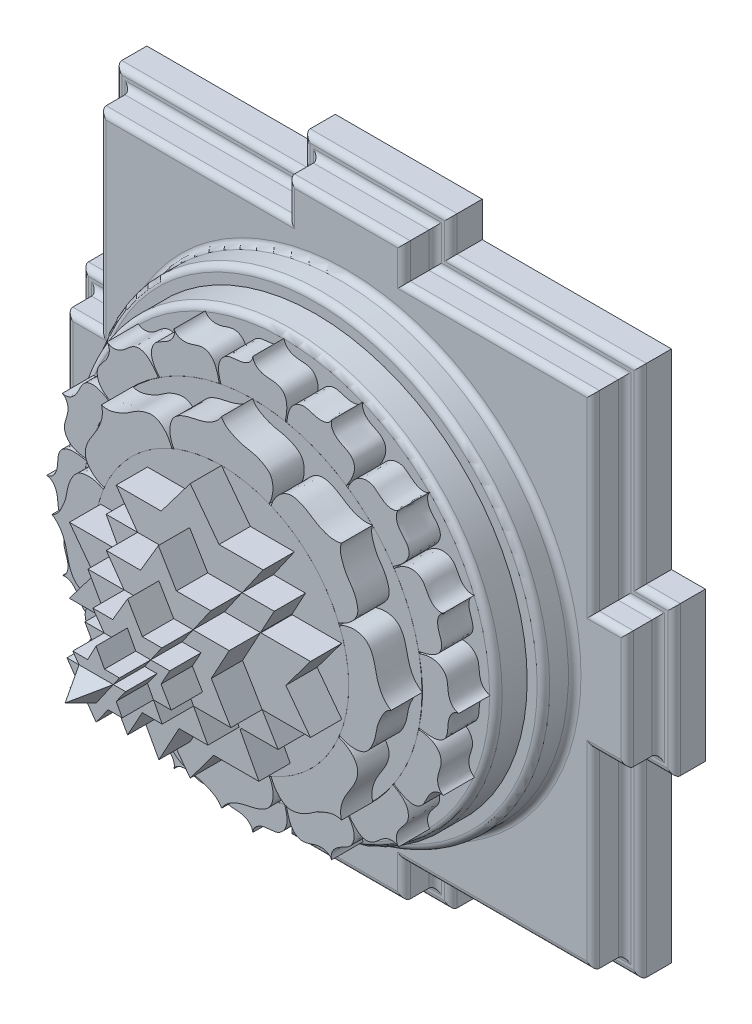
SolidWorks part; units mm, degrees
ref_plane "Front Plane" through (0, 0, 0) normal (0, 0, 1) x (1, 0, 0)
ref_plane "Top Plane" through (0, 0, 0) normal (0, 1, 0) x (1, 0, 0)
ref_plane "Right Plane" through (0, 0, 0) normal (1, 0, 0) x (0, 0, -1)
sketch "Sketch1" plane through (0, 0, 0) normal (0, 0, 1) x (1, 0, 0)
  line L0 (91.8709, 61.5854) -> (97.2817, 61.5854)
  line L1 (8.0648, 7.1622) -> (38.1677, 7.1622)
  line L2 (8.0648, 7.1622) -> (8.0648, 37.7603)
  line L3 (8.0648, 92.1075) -> (38.1677, 92.1075)
  line L4 (91.8709, 7.1622) -> (91.8709, 37.7603)
  line L5 (97.2817, 61.5854) -> (97.2817, 37.7603)
  line L6 (97.2817, 37.7603) -> (91.8709, 37.7603)
  line L7 (91.8709, 61.5854) -> (91.8709, 92.1075)
  line L8 (38.1677, 92.1075) -> (38.1677, 97.7125)
  line L9 (38.1677, 97.7125) -> (61.6437, 97.7125)
  line L10 (61.6437, 97.7125) -> (61.6437, 92.1075)
  line L11 (61.6437, 92.1075) -> (91.8709, 92.1075)
  line L12 (8.0648, 61.5854) -> (2.7372, 61.5854)
  line L13 (2.7372, 61.5854) -> (2.7372, 37.7603)
  line L14 (2.7372, 37.7603) -> (8.0648, 37.7603)
  line L15 (8.0648, 61.5854) -> (8.0648, 92.1075)
  line L16 (38.1677, 7.1622) -> (38.1677, 1.6556)
  line L17 (38.1677, 1.6556) -> (61.6437, 1.6556)
  line L18 (61.6437, 1.6556) -> (61.6437, 7.1622)
  line L19 (61.6437, 7.1622) -> (91.8709, 7.1622)
  line L20 (49.9915, 49.7105) -> (49.9915, 103.8967) construction
  line L21 (49.9915, 49.7105) -> (49.9915, -8.4046) construction
  line L22 (0, 49.6729) -> (100.4125, 49.6729) construction
  line L23 (89.3709, 59.0854) -> (94.7817, 59.0854) construction
  line L24 (94.7817, 59.0854) -> (94.7817, 40.2603) construction
  line L25 (94.7817, 40.2603) -> (89.3709, 40.2603) construction
  line L26 (89.3709, 9.6622) -> (89.3709, 40.2603) construction
  line L27 (59.1437, 9.6622) -> (89.3709, 9.6622) construction
  line L28 (59.1437, 4.1556) -> (59.1437, 9.6622) construction
  line L29 (40.6677, 4.1556) -> (59.1437, 4.1556) construction
  line L30 (40.6677, 9.6622) -> (40.6677, 4.1556) construction
  line L31 (10.5648, 9.6622) -> (40.6677, 9.6622) construction
  line L32 (10.5648, 9.6622) -> (10.5648, 40.2603) construction
  line L33 (5.2372, 40.2603) -> (10.5648, 40.2603) construction
  line L34 (5.2372, 59.0854) -> (5.2372, 40.2603) construction
  line L35 (10.5648, 59.0854) -> (5.2372, 59.0854) construction
  line L36 (10.5648, 59.0854) -> (10.5648, 89.6075) construction
  line L37 (10.5648, 89.6075) -> (40.6677, 89.6075) construction
  line L38 (40.6677, 89.6075) -> (40.6677, 95.2125) construction
  line L39 (40.6677, 95.2125) -> (59.1437, 95.2125) construction
  line L40 (59.1437, 95.2125) -> (59.1437, 89.6075) construction
  line L41 (59.1437, 89.6075) -> (89.3709, 89.6075) construction
  line L42 (89.3709, 59.0854) -> (89.3709, 89.6075) construction
  line L43 (49.9915, 70.039) -> (30.7006, 44.5216) construction
  line L44 (30.7006, 55.0402) -> (69.204, 55.0402) construction
  line L46 (30.7006, 44.5216) -> (69.204, 44.5216) construction
  line L48 (49.9915, 70.039) -> (69.204, 44.5216) construction
  line L49 (49.9915, 29.2962) -> (30.7006, 55.0402) construction
  line L50 (49.9915, 29.2962) -> (69.204, 55.0402) construction
  line L51 (36.5629, 59.0854) -> (63.4118, 59.0854) construction
  line L52 (63.4118, 59.0854) -> (49.9915, 34.3322) construction
  line L53 (49.9915, 34.3322) -> (36.5629, 59.0854) construction
  line L54 (49.9915, 47.1902) -> (38.1677, 63.9162) construction
  line L55 (38.1677, 63.9162) -> (61.6437, 63.9162) construction
  line L56 (61.6437, 63.9162) -> (49.9915, 47.1902) construction
  line L57 (39.0188, 34.3322) -> (49.9523, 55.0402) construction
  line L58 (49.9523, 55.0402) -> (60.9717, 34.3322) construction
  line L59 (60.9717, 34.3322) -> (39.0188, 34.3322) construction
  line L60 (35.9529, 40.2603) -> (64.0301, 40.2603) construction
  line L61 (64.0301, 40.2603) -> (49.9057, 63.9162) construction
  line L62 (49.9057, 63.9162) -> (35.9529, 40.2603) construction
  line L63 (43.016, 47.1902) -> (56.9627, 47.1902) construction
  line L64 (56.9627, 47.1902) -> (49.9874, 59.0854) construction
  line L65 (49.9874, 59.0854) -> (43.016, 47.1902) construction
  line L66 (43.1709, 52.4977) -> (49.9915, 40.2603) construction
  line L67 (49.9915, 40.2603) -> (56.7234, 52.4977) construction
  line L68 (56.7234, 52.4977) -> (43.1709, 52.4977) construction
  line L69 (45.3025, 51.0916) -> (54.675, 51.0916) construction
  line L70 (54.675, 51.0916) -> (49.9523, 44.5216) construction
  line L71 (49.9523, 44.5216) -> (45.3025, 51.0916) construction
  circle A0 centre (49.9915, 49.7105) radius 36.4206 construction
  circle A1 centre (49.9915, 49.7105) radius 33.8286 construction
  circle A2 centre (49.9915, 49.7105) radius 20.3285 construction
  circle A3 centre (49.9915, 49.7105) radius 27.0358 construction
  circle A4 centre (49.9915, 49.7105) radius 27.0358 construction
  circle A5 centre (49.9915, 49.7105) radius 27.0358 construction
  circle A6 centre (49.9915, 49.7105) radius 27.0358 construction
  circle A7 centre (49.9915, 49.7105) radius 27.0358 construction
  circle A8 centre (49.9915, 49.7105) radius 27.0358 construction
  circle A9 centre (49.9915, 49.7105) radius 27.0358 construction
  circle A10 centre (49.9915, 49.7105) radius 27.0358 construction
  spline S0 degree 3 poles (42.3744, 68.558) (41.678, 69.6765) (41.3285, 72.6041) (44.2873, 74.1529) (47.1806, 74.5198) (49.2793, 75.5729) (49.9915, 76.8036) knots 0 0 0 0 0.328948 0.496786 0.694085 1 1 1 1 construction
  spline S1 degree 3 poles (57.6087, 68.558) (58.0096, 69.3799) (58.3859, 70.755) (57.9282, 72.8222) (56.5346, 73.7475) (55.0018, 74.3404) (53.4246, 74.4795) (51.6109, 75.2438) (50.3695, 75.9152) (49.9915, 76.8036) knots 0 0 0 0 0.204713 0.31623 0.449473 0.557768 0.688287 0.80075 1 1 1 1 construction
  spline S2 degree 3 poles (57.9326, 68.4238) (58.2311, 69.7071) (60.0541, 72.0244) (63.2414, 71.0273) (65.5467, 69.241) (67.7754, 68.5015) (69.1492, 68.8682) knots 0 0 0 0 0.328948 0.496786 0.694085 1 1 1 1 construction
  spline S3 degree 3 poles (68.7049, 57.6515) (69.5696, 57.9492) (70.808, 58.6555) (71.9461, 60.4409) (71.6149, 62.0806) (70.9503, 63.5836) (69.9334, 64.7972) (69.1914, 66.6201) (68.7883, 67.9728) (69.1492, 68.8682) knots 0 0 0 0 0.204713 0.31623 0.449473 0.557768 0.688287 0.80075 1 1 1 1 construction
  spline S4 degree 3 poles (68.839, 57.3276) (69.9576, 58.024) (72.8851, 58.3735) (74.4339, 55.4147) (74.8009, 52.5214) (75.8539, 50.4227) (77.0846, 49.7105) knots 0 0 0 0 0.328948 0.496786 0.694085 1 1 1 1 construction
  spline S5 degree 3 poles (68.839, 42.0933) (69.661, 41.6924) (71.0361, 41.3161) (73.1033, 41.7738) (74.0285, 43.1674) (74.6214, 44.7002) (74.7605, 46.2774) (75.5248, 48.091) (76.1963, 49.3325) (77.0846, 49.7105) knots 0 0 0 0 0.204713 0.31623 0.449473 0.557768 0.688287 0.80075 1 1 1 1 construction
  spline S6 degree 3 poles (68.7049, 41.7694) (69.9882, 41.4709) (72.3054, 39.6479) (71.3084, 36.4606) (69.5221, 34.1552) (68.7826, 31.9266) (69.1492, 30.5528) knots 0 0 0 0 0.328948 0.496786 0.694085 1 1 1 1 construction
  spline S7 degree 3 poles (57.9326, 30.9971) (58.2303, 30.1324) (58.9366, 28.894) (60.7219, 27.7559) (62.3616, 28.0871) (63.8647, 28.7517) (65.0783, 29.7686) (66.9012, 30.5106) (68.2538, 30.9137) (69.1492, 30.5528) knots 0 0 0 0 0.204713 0.31623 0.449473 0.557768 0.688287 0.80075 1 1 1 1 construction
  spline S8 degree 3 poles (57.6087, 30.863) (58.305, 29.7444) (58.6546, 26.8169) (55.6958, 25.2681) (52.8025, 24.9011) (50.7037, 23.8481) (49.9915, 22.6174) knots 0 0 0 0 0.328948 0.496786 0.694085 1 1 1 1 construction
  spline S9 degree 3 poles (42.3744, 30.863) (41.9735, 30.041) (41.5972, 28.6659) (42.0549, 26.5987) (43.4485, 25.6734) (44.9812, 25.0806) (46.5584, 24.9415) (48.3721, 24.1772) (49.6136, 23.5057) (49.9915, 22.6174) knots 0 0 0 0 0.204713 0.31623 0.449473 0.557768 0.688287 0.80075 1 1 1 1 construction
  spline S10 degree 3 poles (42.0505, 30.9971) (41.7519, 29.7138) (39.929, 27.3966) (36.7416, 28.3936) (34.4363, 30.1799) (32.2077, 30.9194) (30.8338, 30.5528) knots 0 0 0 0 0.328948 0.496786 0.694085 1 1 1 1 construction
  spline S11 degree 3 poles (31.2782, 41.7694) (30.4135, 41.4717) (29.1751, 40.7654) (28.037, 38.9801) (28.3681, 37.3404) (29.0328, 35.8373) (30.0496, 34.6237) (30.7917, 32.8008) (31.1947, 31.4481) (30.8338, 30.5528) knots 0 0 0 0 0.204713 0.31623 0.449473 0.557768 0.688287 0.80075 1 1 1 1 construction
  spline S12 degree 3 poles (31.144, 42.0933) (30.0255, 41.397) (27.0979, 41.0474) (25.5491, 44.0062) (25.1821, 46.8995) (24.1291, 48.9983) (22.8984, 49.7105) knots 0 0 0 0 0.328948 0.496786 0.694085 1 1 1 1 construction
  spline S13 degree 3 poles (31.144, 57.3276) (30.3221, 57.7285) (28.9469, 58.1048) (26.8798, 57.6471) (25.9545, 56.2535) (25.3616, 54.7207) (25.2225, 53.1436) (24.4582, 51.3299) (23.7868, 50.0884) (22.8984, 49.7105) knots 0 0 0 0 0.204713 0.31623 0.449473 0.557768 0.688287 0.80075 1 1 1 1 construction
  spline S14 degree 3 poles (31.2782, 57.6515) (29.9949, 57.9501) (27.6776, 59.773) (28.6746, 62.9603) (30.461, 65.2657) (31.2005, 67.4943) (30.8338, 68.8682) knots 0 0 0 0 0.328948 0.496786 0.694085 1 1 1 1 construction
  spline S15 degree 3 poles (42.0505, 68.4238) (41.7527, 69.2885) (41.0464, 70.5269) (39.2611, 71.665) (37.6214, 71.3339) (36.1184, 70.6692) (34.9048, 69.6524) (33.0819, 68.9103) (31.7292, 68.5073) (30.8338, 68.8682) knots 0 0 0 0 0.204713 0.31623 0.449473 0.557768 0.688287 0.80075 1 1 1 1 construction
  spline S16 degree 3 poles (44.9079, 76.264) (44.55, 77.2257) (44.1955, 79.0675) (45.7969, 80.7695) (47.2713, 80.8646) (48.8817, 81.0181) (49.933, 81.8258) (49.9915, 82.6408) knots 0 0 0 0 0.329339 0.49933 0.645631 0.769103 1 1 1 1 construction
  spline S17 degree 3 poles (55.1908, 76.2416) (55.3246, 76.8595) (55.4839, 77.9702) (55.3665, 79.4391) (54.6851, 80.4437) (53.6927, 80.8384) (52.5831, 80.8617) (51.0898, 81.0373) (50.087, 81.7878) (49.9915, 82.6408) knots 0 0 0 0 0.191549 0.34424 0.434225 0.546003 0.652539 0.772913 1 1 1 1 construction
  spline S18 degree 3 poles (64.9481, 72.2324) (65.3081, 72.752) (65.8803, 73.7172) (66.334, 75.1192) (66.0889, 76.3082) (65.3231, 77.0525) (64.3069, 77.4987) (62.9945, 78.2324) (62.3552, 79.3095) (62.5934, 80.1342) knots 0 0 0 0 0.191549 0.34424 0.434225 0.546003 0.652539 0.772913 1 1 1 1 construction
  spline S19 degree 3 poles (55.4564, 76.1882) (55.4938, 77.2136) (55.8712, 79.0509) (58.002, 80.0104) (59.4005, 79.5341) (60.9471, 79.0596) (62.2275, 79.4036) (62.5934, 80.1342) knots 0 0 0 0 0.329339 0.49933 0.645631 0.769103 1 1 1 1 construction
  spline S20 degree 3 poles (72.4283, 64.7944) (72.9599, 65.1367) (73.8579, 65.8095) (74.8135, 66.9311) (75.0421, 68.1233) (74.6194, 69.1041) (73.8513, 69.9052) (72.9196, 71.0853) (72.7411, 72.325) (73.2768, 72.9957) knots 0 0 0 0 0.191549 0.34424 0.434225 0.546003 0.652539 0.772913 1 1 1 1 construction
  spline S21 degree 3 poles (65.173, 72.0814) (65.6, 73.0145) (66.6517, 74.5675) (68.9875, 74.6385) (70.0973, 73.6632) (71.3446, 72.633) (72.6591, 72.4609) (73.2768, 72.9957) knots 0 0 0 0 0.329339 0.49933 0.645631 0.769103 1 1 1 1 construction
  spline S22 degree 3 poles (76.4928, 55.06) (77.1149, 55.1728) (78.202, 55.4507) (79.5141, 56.1213) (80.1815, 57.1353) (80.1664, 58.2031) (79.7633, 59.2373) (79.3541, 60.6841) (79.6637, 61.8977) (80.4152, 62.3124) knots 0 0 0 0 0.191549 0.34424 0.434225 0.546003 0.652539 0.772913 1 1 1 1 construction
  spline S23 degree 3 poles (72.5784, 64.5688) (73.3299, 65.2674) (74.8959, 66.2998) (77.0811, 65.4715) (77.7332, 64.1458) (78.4913, 62.7167) (79.6399, 62.0546) (80.4152, 62.3124) knots 0 0 0 0 0.329339 0.49933 0.645631 0.769103 1 1 1 1 construction
  spline S24 degree 3 poles (76.5227, 44.5112) (77.1406, 44.3774) (78.2513, 44.2181) (79.7202, 44.3355) (80.7248, 45.0169) (81.1194, 46.0093) (81.1428, 47.1189) (81.3184, 48.6122) (82.0688, 49.615) (82.9219, 49.7105) knots 0 0 0 0 0.191549 0.34424 0.434225 0.546003 0.652539 0.772913 1 1 1 1 construction
  spline S25 degree 3 poles (76.5451, 54.7941) (77.5068, 55.152) (79.3486, 55.5065) (81.0505, 53.9051) (81.1456, 52.4307) (81.2991, 50.8203) (82.1069, 49.769) (82.9219, 49.7105) knots 0 0 0 0 0.329339 0.49933 0.645631 0.769103 1 1 1 1 construction
  spline S26 degree 3 poles (72.5134, 34.7539) (73.0331, 34.3939) (73.9983, 33.8217) (75.4003, 33.368) (76.5892, 33.6131) (77.3336, 34.3789) (77.7798, 35.3951) (78.5135, 36.7075) (79.5906, 37.3468) (80.4152, 37.1086) knots 0 0 0 0 0.191549 0.34424 0.434225 0.546003 0.652539 0.772913 1 1 1 1 construction
  spline S27 degree 3 poles (76.4692, 44.2456) (77.4947, 44.2082) (79.332, 43.8308) (80.2915, 41.7) (79.8152, 40.3015) (79.3407, 38.7549) (79.6847, 37.4745) (80.4152, 37.1086) knots 0 0 0 0 0.329339 0.49933 0.645631 0.769103 1 1 1 1 construction
  spline S28 degree 3 poles (65.0754, 27.2737) (65.4177, 26.7421) (66.0905, 25.8441) (67.2122, 24.8885) (68.4044, 24.6599) (69.3851, 25.0826) (70.1863, 25.8507) (71.3664, 26.7824) (72.6061, 26.9608) (73.2768, 26.4252) knots 0 0 0 0 0.191549 0.34424 0.434225 0.546003 0.652539 0.772913 1 1 1 1 construction
  spline S29 degree 3 poles (72.3624, 34.529) (73.2955, 34.102) (74.8485, 33.0503) (74.9196, 30.7145) (73.9443, 29.6047) (72.9141, 28.3574) (72.7419, 27.0429) (73.2768, 26.4252) knots 0 0 0 0 0.329339 0.49933 0.645631 0.769103 1 1 1 1 construction
  spline S30 degree 3 poles (55.341, 23.2092) (55.4539, 22.5871) (55.7318, 21.5) (56.4024, 20.1879) (57.4164, 19.5205) (58.4842, 19.5356) (59.5183, 19.9387) (60.9651, 20.3479) (62.1787, 20.0383) (62.5934, 19.2868) knots 0 0 0 0 0.191549 0.34424 0.434225 0.546003 0.652539 0.772913 1 1 1 1 construction
  spline S31 degree 3 poles (64.8498, 27.1236) (65.5485, 26.3721) (66.5808, 24.8061) (65.7526, 22.6209) (64.4269, 21.9688) (62.9977, 21.2107) (62.3356, 20.0621) (62.5934, 19.2868) knots 0 0 0 0 0.329339 0.49933 0.645631 0.769103 1 1 1 1 construction
  spline S32 degree 3 poles (44.7922, 23.1793) (44.6584, 22.5614) (44.4992, 21.4507) (44.6166, 19.9818) (45.298, 18.9772) (46.2903, 18.5825) (47.4, 18.5592) (48.8932, 18.3836) (49.896, 17.6331) (49.9915, 16.7801) knots 0 0 0 0 0.191549 0.34424 0.434225 0.546003 0.652539 0.772913 1 1 1 1 construction
  spline S33 degree 3 poles (55.0752, 23.1569) (55.4331, 22.1952) (55.7875, 20.3534) (54.1861, 18.6515) (52.7118, 18.5564) (51.1013, 18.4029) (50.0501, 17.5951) (49.9915, 16.7801) knots 0 0 0 0 0.329339 0.49933 0.645631 0.769103 1 1 1 1 construction
  spline S34 degree 3 poles (35.035, 27.1886) (34.6749, 26.6689) (34.1027, 25.7037) (33.6491, 24.3017) (33.8941, 23.1128) (34.6599, 22.3684) (35.6762, 21.9222) (36.9886, 21.1885) (37.6278, 20.1114) (37.3896, 19.2868) knots 0 0 0 0 0.191549 0.34424 0.434225 0.546003 0.652539 0.772913 1 1 1 1 construction
  spline S35 degree 3 poles (44.5266, 23.2327) (44.4893, 22.2073) (44.1119, 20.37) (41.9811, 19.4105) (40.5825, 19.8868) (39.0359, 20.3613) (37.7556, 20.0173) (37.3896, 19.2868) knots 0 0 0 0 0.329339 0.49933 0.645631 0.769103 1 1 1 1 construction
  spline S36 degree 3 poles (27.5547, 34.6266) (27.0232, 34.2842) (26.1252, 33.6115) (25.1695, 32.4898) (24.941, 31.2976) (25.3636, 30.3169) (26.1318, 29.5157) (27.0635, 28.3356) (27.2419, 27.0959) (26.7062, 26.4252) knots 0 0 0 0 0.191549 0.34424 0.434225 0.546003 0.652539 0.772913 1 1 1 1 construction
  spline S37 degree 3 poles (34.81, 27.3396) (34.3831, 26.4065) (33.3313, 24.8535) (30.9955, 24.7824) (29.8858, 25.7577) (28.6385, 26.7879) (27.3239, 26.9601) (26.7062, 26.4252) knots 0 0 0 0 0.329339 0.49933 0.645631 0.769103 1 1 1 1 construction
  spline S38 degree 3 poles (23.4902, 44.361) (22.8682, 44.2481) (21.7811, 43.9702) (20.4689, 43.2996) (19.8015, 42.2856) (19.8167, 41.2178) (20.2198, 40.1837) (20.629, 38.7369) (20.3194, 37.5232) (19.5678, 37.1086) knots 0 0 0 0 0.191549 0.34424 0.434225 0.546003 0.652539 0.772913 1 1 1 1 construction
  spline S39 degree 3 poles (27.4047, 34.8522) (26.6532, 34.1535) (25.0872, 33.1212) (22.902, 33.9494) (22.2499, 35.2751) (21.4918, 36.7043) (20.3432, 37.3664) (19.5678, 37.1086) knots 0 0 0 0 0.329339 0.49933 0.645631 0.769103 1 1 1 1 construction
  spline S40 degree 3 poles (23.4604, 54.9098) (22.8425, 55.0435) (21.7318, 55.2028) (20.2629, 55.0854) (19.2583, 54.404) (18.8636, 53.4117) (18.8403, 52.302) (18.6646, 50.8088) (17.9142, 49.806) (17.0612, 49.7105) knots 0 0 0 0 0.191549 0.34424 0.434225 0.546003 0.652539 0.772913 1 1 1 1 construction
  spline S41 degree 3 poles (23.438, 44.6268) (22.4763, 44.2689) (20.6345, 43.9145) (18.9325, 45.5159) (18.8374, 46.9902) (18.6839, 48.6007) (17.8762, 49.6519) (17.0612, 49.7105) knots 0 0 0 0 0.329339 0.49933 0.645631 0.769103 1 1 1 1 construction
  spline S42 degree 3 poles (27.4696, 64.667) (26.95, 65.0271) (25.9847, 65.5993) (24.5828, 66.0529) (23.3938, 65.8079) (22.6495, 65.0421) (22.2033, 64.0258) (21.4696, 62.7134) (20.3925, 62.0742) (19.5678, 62.3124) knots 0 0 0 0 0.191549 0.34424 0.434225 0.546003 0.652539 0.772913 1 1 1 1 construction
  spline S43 degree 3 poles (23.5138, 55.1754) (22.4884, 55.2127) (20.6511, 55.5901) (19.6915, 57.7209) (20.1679, 59.1194) (20.6424, 60.666) (20.2984, 61.9464) (19.5678, 62.3124) knots 0 0 0 0 0.329339 0.49933 0.645631 0.769103 1 1 1 1 construction
  spline S44 degree 3 poles (34.9076, 72.1473) (34.5653, 72.6788) (33.8925, 73.5768) (32.7709, 74.5325) (31.5787, 74.761) (30.5979, 74.3384) (29.7968, 73.5702) (28.6167, 72.6385) (27.377, 72.4601) (26.7062, 72.9957) knots 0 0 0 0 0.191549 0.34424 0.434225 0.546003 0.652539 0.772913 1 1 1 1 construction
  spline S45 degree 3 poles (27.6206, 64.892) (26.6875, 65.3189) (25.1345, 66.3706) (25.0635, 68.7065) (26.0388, 69.8162) (27.069, 71.0635) (27.2411, 72.3781) (26.7062, 72.9957) knots 0 0 0 0 0.329339 0.49933 0.645631 0.769103 1 1 1 1 construction
  spline S46 degree 3 poles (44.642, 76.2117) (44.5292, 76.8338) (44.2513, 77.9209) (43.5807, 79.233) (42.5667, 79.9005) (41.4989, 79.8853) (40.4647, 79.4822) (39.0179, 79.073) (37.8043, 79.3826) (37.3896, 80.1342) knots 0 0 0 0 0.191549 0.34424 0.434225 0.546003 0.652539 0.772913 1 1 1 1 construction
  spline S47 degree 3 poles (35.1332, 72.2973) (34.4345, 73.0488) (33.4022, 74.6148) (34.2304, 76.8) (35.5562, 77.4521) (36.9853, 78.2102) (37.6474, 79.3588) (37.3896, 80.1342) knots 0 0 0 0 0.329339 0.49933 0.645631 0.769103 1 1 1 1 construction
  point P26 (38.1677, 4.4089)
  point P28 (94.5763, 61.5854)
  point P29 (61.6437, 94.91)
  point P74 (0, 0)
  point P219 (49.9915, 49.7105)
  point P492 (49.9915, 49.7105)
  dimension "D1" = 49.9915
  dimension "D2" = 49.6729
  dimension "D3" = 5.4109
  dimension "D4" = 30.598
  dimension "D5" = 30.2271
  dimension "D6" = 23.476
  dimension "D7" = 11.8238
  dimension "D8" = 48.0172
  dimension "D9" = 42.5106
  dimension "D10" = 30.598
  dimension "D11" = 41.9268
  dimension "D12" = 11.9126
  dimension "D13" = 42.4346
  dimension "D14" = 5.605
  dimension "D15" = 11.6522
  dimension "D16" = 47.2543
  dimension "D17" = 2.5
  dimension "D18" = 8
extrude "Boss-Extrude1" add sketch "Sketch1" along normal blind 5 contours L5 L6 L4 L19 L18 L17 L16 L1 L2 L14 L13 L12 L15 L3 L8 L9 L10 L11 L7 L0
sketch "Sketch3" plane through (0, 0, 5) normal (0, 0, 1) x (1, 0, 0)
  line L0 (59.1437, 95.2125) -> (59.1437, 89.6075) construction
  line L1 (59.1437, 89.6075) -> (89.3709, 89.6075) construction
  line L2 (10.5648, 89.6075) -> (40.6677, 89.6075) construction
  line L3 (40.6677, 89.6075) -> (40.6677, 95.2125) construction
  line L4 (40.6677, 95.2125) -> (59.1437, 95.2125) construction
  line L5 (10.5648, 59.0854) -> (10.5648, 89.6075) construction
  line L6 (10.5648, 59.0854) -> (5.2372, 59.0854) construction
  line L7 (5.2372, 40.2603) -> (10.5648, 40.2603) construction
  line L8 (5.2372, 59.0854) -> (5.2372, 40.2603) construction
  line L9 (10.5648, 9.6622) -> (10.5648, 40.2603) construction
  line L10 (10.5648, 9.6622) -> (40.6677, 9.6622) construction
  line L11 (40.6677, 9.6622) -> (40.6677, 4.1556) construction
  line L12 (40.6677, 4.1556) -> (59.1437, 4.1556) construction
  line L13 (59.1437, 4.1556) -> (59.1437, 9.6622) construction
  line L14 (59.1437, 9.6622) -> (89.3709, 9.6622) construction
  line L15 (89.3709, 59.0854) -> (89.3709, 89.6075) construction
  line L16 (89.3709, 59.0854) -> (94.7817, 59.0854) construction
  line L17 (94.7817, 59.0854) -> (94.7817, 40.2603) construction
  line L18 (94.7817, 40.2603) -> (89.3709, 40.2603) construction
  line L19 (89.3709, 9.6622) -> (89.3709, 40.2603) construction
  line L20 (59.1437, 95.2125) -> (59.1437, 89.6075)
  line L21 (59.1437, 89.6075) -> (89.3709, 89.6075)
  line L22 (10.5648, 89.6075) -> (40.6677, 89.6075)
  line L23 (40.6677, 89.6075) -> (40.6677, 95.2125)
  line L24 (40.6677, 95.2125) -> (59.1437, 95.2125)
  line L25 (10.5648, 59.0854) -> (10.5648, 89.6075)
  line L26 (10.5648, 59.0854) -> (5.2372, 59.0854)
  line L27 (5.2372, 40.2603) -> (10.5648, 40.2603)
  line L28 (5.2372, 59.0854) -> (5.2372, 40.2603)
  line L29 (10.5648, 9.6622) -> (10.5648, 40.2603)
  line L30 (10.5648, 9.6622) -> (40.6677, 9.6622)
  line L31 (40.6677, 9.6622) -> (40.6677, 4.1556)
  line L32 (40.6677, 4.1556) -> (59.1437, 4.1556)
  line L33 (59.1437, 4.1556) -> (59.1437, 9.6622)
  line L34 (59.1437, 9.6622) -> (89.3709, 9.6622)
  line L35 (89.3709, 59.0854) -> (89.3709, 89.6075)
  line L36 (89.3709, 59.0854) -> (94.7817, 59.0854)
  line L37 (94.7817, 59.0854) -> (94.7817, 40.2603)
  line L38 (94.7817, 40.2603) -> (89.3709, 40.2603)
  line L39 (89.3709, 9.6622) -> (89.3709, 40.2603)
extrude "Boss-Extrude2" add sketch "Sketch3" along normal blind 5
sketch "Sketch4" plane through (0, 0, 10) normal (0, 0, 1) x (1, 0, 0)
  circle A0 centre (49.9915, 49.7105) radius 36.4206 construction
  circle A1 centre (49.9915, 49.7105) radius 36.4206
extrude "Boss-Extrude3" add sketch "Sketch4" along normal blind 5
sketch "Sketch5" plane through (0, 0, 15) normal (0, 0, 1) x (1, 0, 0)
  circle A0 centre (49.9915, 49.7105) radius 33.8286
  dimension "D1" = 67.6572
extrude "Boss-Extrude4" add sketch "Sketch5" along normal blind 5 contours A0
sketch "Sketch6" plane through (0, 0, 20) normal (0, 0, 1) x (1, 0, 0)
  circle A0 centre (49.9915, 49.7105) radius 27.0358 construction
  circle A1 centre (49.9915, 49.7105) radius 27.0358
extrude "Boss-Extrude5" add sketch "Sketch6" along normal blind 5
sketch "Sketch7" plane through (0, 0, 25) normal (0, 0, 1) x (1, 0, 0)
  circle A0 centre (49.9915, 49.7105) radius 20.3285 construction
  circle A1 centre (49.9915, 49.7105) radius 20.3285
extrude "Boss-Extrude6" add sketch "Sketch7" along normal blind 5
sketch "Sketch9" plane through (0, 0, 20) normal (0, 0, 1) x (1, 0, 0)
  circle A0 centre (49.9915, 49.7105) radius 27.0358 construction
  arc A1 (55.1908, 76.2416) -> (44.9079, 76.264) centre (49.9915, 49.7105) ccw construction
  arc A2 (55.1908, 76.2416) -> (44.9079, 76.264) centre (49.9915, 49.7105) ccw
  circle A3 centre (49.9915, 49.7105) radius 27.0358
  arc A4 (55.1908, 76.2416) -> (44.9079, 76.264) centre (49.9915, 49.7105) ccw construction
  arc A5 (35.1332, 72.2973) -> (44.642, 76.2117) centre (49.9915, 49.7105) cw
  arc A6 (27.6206, 64.892) -> (34.9076, 72.1473) centre (48.0049, 51.7058) cw
  arc A7 (23.5138, 55.1754) -> (27.4696, 64.667) centre (49.9915, 49.7105) cw
  arc A8 (23.438, 44.6268) -> (23.4604, 54.9098) centre (47.1759, 49.7166) cw
  arc A9 (27.4047, 34.8522) -> (23.4902, 44.361) centre (49.9915, 49.7105) cw
  arc A10 (27.5547, 34.6266) -> (34.81, 27.3396) centre (47.9962, 47.7239) ccw
  arc A11 (44.5266, 23.2327) -> (35.035, 27.1886) centre (49.9915, 49.7105) cw
  arc A12 (44.7922, 23.1793) -> (55.0752, 23.1569) centre (49.9854, 46.8948) ccw
  arc A13 (55.341, 23.2092) -> (64.8498, 27.1236) centre (49.9915, 49.7105) ccw
  arc A14 (65.0754, 27.2737) -> (72.3624, 34.529) centre (51.9781, 47.7152) ccw
  arc A15 (76.4692, 44.2456) -> (72.5134, 34.7539) centre (50.1438, 49.647) cw
  arc A16 (76.5227, 44.5112) -> (76.5451, 54.7941) centre (52.8072, 49.7043) ccw
  arc A17 (76.4928, 55.06) -> (72.5784, 64.5688) centre (49.9915, 49.7105) ccw
  arc A18 (65.173, 72.0814) -> (72.4283, 64.7944) centre (49.9915, 49.7105) cw
  arc A19 (64.9481, 72.2324) -> (55.4564, 76.1882) centre (49.9915, 49.7105) ccw
  spline S0 degree 3 poles (1764.2112, -960.3099) (-69.3075, 53.963) (57.4942, 52.8152) (55.3665, 79.4391) (54.6851, 80.4437) (53.6927, 80.8384) (52.5831, 80.8617) (40.1786, 82.3207) (43.7036, 152.2728) (1963.2935, 662.1987) knots -7.436288 -7.436288 -7.436288 -7.436288 0.191549 0.34424 0.434225 0.546003 0.652539 0.772913 4.317425 4.317425 4.317425 4.317425 only from (55.1908, 76.2416) to (49.9915, 82.6408) construction
  spline S1 degree 3 poles (-1389.0117, 1470.1576) (184.5093, -0.5268) (32.8586, 67.019) (45.7969, 80.7695) (47.2713, 80.8646) (59.2966, 82.0107) (61.7469, 154.9548) (-1940.7929, 264.7251) knots -4.570623 -4.570623 -4.570623 -4.570623 0.329339 0.49933 0.645631 0.769103 4.237869 4.237869 4.237869 4.237869 only from (44.9079, 76.264) to (49.9915, 82.6408) construction
  spline S2 degree 3 poles (55.1908, 76.2416) (55.3246, 76.8595) (55.4839, 77.9702) (55.3665, 79.4391) (54.6851, 80.4437) (53.6927, 80.8384) (52.5831, 80.8617) (51.0898, 81.0373) (50.087, 81.7878) (49.9915, 82.6408) knots 0 0 0 0 0.191549 0.34424 0.434225 0.546003 0.652539 0.772913 1 1 1 1
  spline S3 degree 3 poles (44.9079, 76.264) (44.55, 77.2257) (44.1955, 79.0675) (45.7969, 80.7695) (47.2713, 80.8646) (48.8817, 81.0181) (49.933, 81.8258) (49.9915, 82.6408) knots 0 0 0 0 0.329339 0.49933 0.645631 0.769103 1 1 1 1
  spline S4 degree 3 poles (2020.2421, -227.4232) (-61.8538, 7.9856) (55.735, 55.45) (43.5807, 79.233) (42.5667, 79.9005) (41.4989, 79.8853) (40.4647, 79.4822) (28.4461, 76.0831) (4.9333, 142.0594) (1583.263, 1347.7648) knots -7.436288 -7.436288 -7.436288 -7.436288 0.191549 0.34424 0.434225 0.546003 0.652539 0.772913 4.317425 4.317425 4.317425 4.317425 only from (44.642, 76.2117) to (37.3896, 80.1342) construction
  spline S5 degree 3 poles (-1823.0557, 811.3498) (193.4947, 54.775) (27.5391, 59.145) (34.2304, 76.8) (35.5562, 77.4521) (46.2275, 83.1129) (20.5768, 151.4421) (-1871.536, -513.4821) knots -4.570623 -4.570623 -4.570623 -4.570623 0.329339 0.49933 0.645631 0.769103 4.237869 4.237869 4.237869 4.237869 only from (35.1332, 72.2973) to (37.3896, 80.1342) construction
  spline S6 degree 3 poles (1976.3202, 547.6546) (-37.3726, -31.6397) (53.1014, 57.211) (32.7709, 74.5325) (31.5787, 74.761) (30.5979, 74.3384) (29.7968, 73.5702) (19.9938, 65.8306) (-26.9772, 117.7867) (969.8058, 1835.7139) knots -7.436288 -7.436288 -7.436288 -7.436288 0.191549 0.34424 0.434225 0.546003 0.652539 0.772913 4.317425 4.317425 4.317425 4.317425 only from (34.9076, 72.1473) to (26.7062, 72.9957) construction
  spline S7 degree 3 poles (-1971.9452, 36.5894) (180.633, 109.3058) (25.6378, 49.8347) (25.0635, 68.7065) (26.0388, 69.8162) (33.7315, 79.1299) (-16.1152, 132.4417) (-1509.7439, -1205.9484) knots -4.570623 -4.570623 -4.570623 -4.570623 0.329339 0.49933 0.645631 0.769103 4.237869 4.237869 4.237869 4.237869 only from (27.6206, 64.892) to (26.7062, 72.9957) construction
  spline S8 degree 3 poles (1639.1322, 1246.9249) (0.4089, -58.8801) (49.9943, 57.8302) (24.5828, 66.0529) (23.3938, 65.8079) (22.6495, 65.0421) (22.2033, 64.0258) (16.1083, 53.1239) (-47.17, 83.15) (216.3152, 2051.7601) knots -7.436288 -7.436288 -7.436288 -7.436288 0.191549 0.34424 0.434225 0.546003 0.652539 0.772913 4.317425 4.317425 4.317425 4.317425 only from (27.4696, 64.667) to (19.5678, 62.3124) construction
  spline S9 degree 3 poles (-1370.4556, -1389.2927) (100.2288, 184.2282) (32.683, 32.5776) (18.9325, 45.5159) (18.8374, 46.9902) (17.6913, 59.0155) (-55.2528, 61.4658) (-165.0231, -1941.0739) knots -4.570623 -4.570623 -4.570623 -4.570623 0.329339 0.49933 0.645631 0.769103 4.237869 4.237869 4.237869 4.237869 only from (23.438, 44.6268) to (17.0612, 49.7105) construction
  spline S10 degree 3 poles (-1813.0132, -736.1735) (147.8824, 154.7637) (27.444, 40.5054) (19.6915, 57.7209) (20.1679, 59.1194) (23.7109, 70.668) (-42.743, 100.8462) (-910.4963, -1707.252) knots -4.570623 -4.570623 -4.570623 -4.570623 0.329339 0.49933 0.645631 0.769103 4.237869 4.237869 4.237869 4.237869 only from (23.5138, 55.1754) to (19.5678, 62.3124) construction
  spline S11 degree 3 poles (1060.0119, 1763.9302) (45.739, -69.5885) (46.8868, 57.2132) (20.2629, 55.0854) (19.2583, 54.404) (18.8636, 53.4117) (18.8403, 52.302) (17.3813, 39.8975) (-52.5708, 43.4225) (-562.4967, 1963.0125) knots -7.436288 -7.436288 -7.436288 -7.436288 0.191549 0.34424 0.434225 0.546003 0.652539 0.772913 4.317425 4.317425 4.317425 4.317425 only from (23.4604, 54.9098) to (17.0612, 49.7105) construction
  spline S12 degree 3 poles (327.1252, 2019.961) (91.7164, -62.1348) (44.252, 55.4539) (20.4689, 43.2996) (19.8015, 42.2856) (19.8167, 41.2178) (20.2198, 40.1837) (23.6189, 28.1651) (-42.3574, 4.6523) (-1248.0628, 1582.982) knots -7.436288 -7.436288 -7.436288 -7.436288 0.191549 0.34424 0.434225 0.546003 0.652539 0.772913 4.317425 4.317425 4.317425 4.317425 only from (23.4902, 44.361) to (19.5678, 37.1086) construction
  spline S13 degree 3 poles (-711.6479, -1823.3367) (44.927, 193.2136) (40.557, 27.258) (22.902, 33.9494) (22.2499, 35.2751) (16.5891, 45.9465) (-51.7401, 20.2957) (613.1841, -1871.817) knots -4.570623 -4.570623 -4.570623 -4.570623 0.329339 0.49933 0.645631 0.769103 4.237869 4.237869 4.237869 4.237869 only from (27.4047, 34.8522) to (19.5678, 37.1086) construction
  spline S14 degree 3 poles (-447.9526, 1976.0391) (131.3416, -37.6537) (42.4909, 52.8203) (25.1695, 32.4898) (24.941, 31.2976) (25.3636, 30.3169) (26.1318, 29.5157) (33.8714, 19.7127) (-18.0847, -27.2583) (-1736.0119, 969.5247) knots -7.436288 -7.436288 -7.436288 -7.436288 0.191549 0.34424 0.434225 0.546003 0.652539 0.772913 4.317425 4.317425 4.317425 4.317425 only from (27.5547, 34.6266) to (26.7062, 26.4252) construction
  spline S15 degree 3 poles (63.1126, -1972.2263) (-9.6038, 180.352) (49.8673, 25.3567) (30.9955, 24.7824) (29.8858, 25.7577) (20.5721, 33.4504) (-32.7397, -16.3962) (1305.6504, -1510.025) knots -4.570623 -4.570623 -4.570623 -4.570623 0.329339 0.49933 0.645631 0.769103 4.237869 4.237869 4.237869 4.237869 only from (34.81, 27.3396) to (26.7062, 26.4252) construction
  spline S16 degree 3 poles (-1147.2229, 1638.8511) (158.5821, 0.1279) (41.8718, 49.7132) (33.6491, 24.3017) (33.8941, 23.1128) (34.6599, 22.3684) (35.6762, 21.9222) (46.5781, 15.8273) (16.5519, -47.451) (-1952.0581, 216.0341) knots -7.436288 -7.436288 -7.436288 -7.436288 0.191549 0.34424 0.434225 0.546003 0.652539 0.772913 4.317425 4.317425 4.317425 4.317425 only from (35.035, 27.1886) to (37.3896, 19.2868) construction
  spline S17 degree 3 poles (835.8755, -1813.2943) (-55.0617, 147.6013) (59.1966, 27.163) (41.9811, 19.4105) (40.5825, 19.8868) (29.034, 23.4298) (-1.1442, -43.024) (1806.954, -910.7773) knots -4.570623 -4.570623 -4.570623 -4.570623 0.329339 0.49933 0.645631 0.769103 4.237869 4.237869 4.237869 4.237869 only from (44.5266, 23.2327) to (37.3896, 19.2868) construction
  spline S18 degree 3 poles (-1664.2282, 1059.7309) (169.2905, 45.4579) (42.4888, 46.6058) (44.6166, 19.9818) (45.298, 18.9772) (46.2903, 18.5825) (47.4, 18.5592) (59.8045, 17.1002) (56.2795, -52.8518) (-1863.3105, -562.7778) knots -7.436288 -7.436288 -7.436288 -7.436288 0.191549 0.34424 0.434225 0.546003 0.652539 0.772913 4.317425 4.317425 4.317425 4.317425 only from (44.7922, 23.1793) to (49.9915, 16.7801) construction
  spline S19 degree 3 poles (1488.9947, -1370.7367) (-84.5262, 99.9477) (67.1244, 32.4019) (54.1861, 18.6515) (52.7118, 18.5564) (40.6864, 17.4102) (38.2362, -55.5338) (2040.7759, -165.3041) knots -4.570623 -4.570623 -4.570623 -4.570623 0.329339 0.49933 0.645631 0.769103 4.237869 4.237869 4.237869 4.237869 only from (55.0752, 23.1569) to (49.9915, 16.7801) construction
  spline S20 degree 3 poles (-1920.259, 326.8442) (161.8368, 91.4354) (44.2481, 43.9709) (56.4024, 20.1879) (57.4164, 19.5205) (58.4842, 19.5356) (59.5183, 19.9387) (71.5369, 23.3378) (95.0497, -42.6384) (-1483.28, -1248.3438) knots -7.436288 -7.436288 -7.436288 -7.436288 0.191549 0.34424 0.434225 0.546003 0.652539 0.772913 4.317425 4.317425 4.317425 4.317425 only from (55.341, 23.2092) to (62.5934, 19.2868) construction
  spline S21 degree 3 poles (1923.0387, -711.9289) (-93.5116, 44.6459) (72.4439, 40.2759) (65.7526, 22.6209) (64.4269, 21.9688) (53.7555, 16.308) (79.4063, -52.0212) (1971.519, 612.9031) knots -4.570623 -4.570623 -4.570623 -4.570623 0.329339 0.49933 0.645631 0.769103 4.237869 4.237869 4.237869 4.237869 only from (64.8498, 27.1236) to (62.5934, 19.2868) construction
  spline S22 degree 3 poles (-1876.3371, -448.2336) (137.3557, 131.0606) (46.8817, 42.2099) (67.2122, 24.8885) (68.4044, 24.6599) (69.3851, 25.0826) (70.1863, 25.8507) (79.9893, 33.5904) (126.9603, -18.3658) (-869.8227, -1736.2929) knots -7.436288 -7.436288 -7.436288 -7.436288 0.191549 0.34424 0.434225 0.546003 0.652539 0.772913 4.317425 4.317425 4.317425 4.317425 only from (65.0754, 27.2737) to (73.2768, 26.4252) construction
  spline S23 degree 3 poles (2071.9283, 62.8316) (-80.65, -9.8849) (74.3453, 49.5863) (74.9196, 30.7145) (73.9443, 29.6047) (66.2516, 20.2911) (116.0982, -33.0208) (1609.727, 1305.3693) knots -4.570623 -4.570623 -4.570623 -4.570623 0.329339 0.49933 0.645631 0.769103 4.237869 4.237869 4.237869 4.237869 only from (72.3624, 34.529) to (73.2768, 26.4252) construction
  spline S24 degree 3 poles (-1539.1491, -1147.5039) (99.5741, 158.301) (49.9887, 41.5907) (75.4003, 33.368) (76.5892, 33.6131) (77.3336, 34.3789) (77.7798, 35.3951) (83.8747, 46.2971) (147.153, 16.2709) (-116.3321, -1952.3392) knots -7.436288 -7.436288 -7.436288 -7.436288 0.191549 0.34424 0.434225 0.546003 0.652539 0.772913 4.317425 4.317425 4.317425 4.317425 only from (72.5134, 34.7539) to (80.4152, 37.1086) construction
  spline S25 degree 3 poles (1912.9963, 835.5945) (-47.8993, -55.3428) (72.539, 58.9155) (80.2915, 41.7) (79.8152, 40.3015) (76.2721, 28.7529) (142.726, -1.4253) (1010.4793, 1806.6729) knots -4.570623 -4.570623 -4.570623 -4.570623 0.329339 0.49933 0.645631 0.769103 4.237869 4.237869 4.237869 4.237869 only from (76.4692, 44.2456) to (80.4152, 37.1086) construction
  spline S26 degree 3 poles (-960.0289, -1664.5092) (54.2441, 169.0095) (53.0962, 42.2078) (79.7202, 44.3355) (80.7248, 45.0169) (81.1194, 46.0093) (81.1428, 47.1189) (82.6018, 59.5234) (152.5538, 55.9984) (662.4797, -1863.5916) knots -7.436288 -7.436288 -7.436288 -7.436288 0.191549 0.34424 0.434225 0.546003 0.652539 0.772913 4.317425 4.317425 4.317425 4.317425 only from (76.5227, 44.5112) to (82.9219, 49.7105) construction
  spline S27 degree 3 poles (1470.4387, 1488.7137) (-0.2457, -84.8073) (67.3001, 66.8434) (81.0505, 53.9051) (81.1456, 52.4307) (82.2918, 40.4054) (155.2358, 37.9551) (265.0061, 2040.4949) knots -4.570623 -4.570623 -4.570623 -4.570623 0.329339 0.49933 0.645631 0.769103 4.237869 4.237869 4.237869 4.237869 only from (76.5451, 54.7941) to (82.9219, 49.7105) construction
  spline S28 degree 3 poles (-227.1422, -1920.5401) (8.2666, 161.5558) (55.7311, 43.967) (79.5141, 56.1213) (80.1815, 57.1353) (80.1664, 58.2031) (79.7633, 59.2373) (76.3642, 71.2559) (142.3404, 94.7687) (1348.0458, -1483.561) knots -7.436288 -7.436288 -7.436288 -7.436288 0.191549 0.34424 0.434225 0.546003 0.652539 0.772913 4.317425 4.317425 4.317425 4.317425 only from (76.4928, 55.06) to (80.4152, 62.3124) construction
  spline S29 degree 3 poles (811.6309, 1922.7577) (55.0561, -93.7927) (59.4261, 72.1629) (77.0811, 65.4715) (77.7332, 64.1458) (83.3939, 53.4745) (151.7232, 79.1252) (-513.2011, 1971.238) knots -4.570623 -4.570623 -4.570623 -4.570623 0.329339 0.49933 0.645631 0.769103 4.237869 4.237869 4.237869 4.237869 only from (72.5784, 64.5688) to (80.4152, 62.3124) construction
  spline S30 degree 3 poles (547.9356, -1876.6182) (-31.3586, 137.0746) (57.4921, 46.6006) (74.8135, 66.9311) (75.0421, 68.1233) (74.6194, 69.1041) (73.8513, 69.9052) (66.1116, 79.7082) (118.0678, 126.6792) (1835.9949, -870.1038) knots -7.436288 -7.436288 -7.436288 -7.436288 0.191549 0.34424 0.434225 0.546003 0.652539 0.772913 4.317425 4.317425 4.317425 4.317425 only from (72.4283, 64.7944) to (73.2768, 72.9957) construction
  spline S31 degree 3 poles (36.8704, 2071.6472) (109.5868, -80.931) (50.1157, 74.0642) (68.9875, 74.6385) (70.0973, 73.6632) (79.4109, 65.9705) (132.7228, 115.8172) (-1205.6673, 1609.4459) knots -4.570623 -4.570623 -4.570623 -4.570623 0.329339 0.49933 0.645631 0.769103 4.237869 4.237869 4.237869 4.237869 only from (65.173, 72.0814) to (73.2768, 72.9957) construction
  spline S32 degree 3 poles (1247.2059, -1539.4302) (-58.599, 99.2931) (58.1112, 49.7077) (66.334, 75.1192) (66.0889, 76.3082) (65.3231, 77.0525) (64.3069, 77.4987) (53.4049, 83.5937) (83.4311, 146.872) (2052.0412, -116.6132) knots -7.436288 -7.436288 -7.436288 -7.436288 0.191549 0.34424 0.434225 0.546003 0.652539 0.772913 4.317425 4.317425 4.317425 4.317425 only from (64.9481, 72.2324) to (62.5934, 80.1342) construction
  spline S33 degree 3 poles (-735.8925, 1912.7152) (155.0448, -48.1804) (40.7865, 72.2579) (58.002, 80.0104) (59.4005, 79.5341) (70.9491, 75.9911) (101.1273, 142.445) (-1706.9709, 1010.1983) knots -4.570623 -4.570623 -4.570623 -4.570623 0.329339 0.49933 0.645631 0.769103 4.237869 4.237869 4.237869 4.237869 only from (55.4564, 76.1882) to (62.5934, 80.1342) construction
  spline S34 degree 3 poles (44.642, 76.2117) (44.5292, 76.8338) (44.2513, 77.9209) (43.5807, 79.233) (42.5667, 79.9005) (41.4989, 79.8853) (40.4647, 79.4822) (39.0179, 79.073) (37.8043, 79.3826) (37.3896, 80.1342) knots 0 0 0 0 0.191549 0.34424 0.434225 0.546003 0.652539 0.772913 1 1 1 1
  spline S35 degree 3 poles (35.1332, 72.2973) (34.4345, 73.0488) (33.4022, 74.6148) (34.2304, 76.8) (35.5562, 77.4521) (36.9853, 78.2102) (37.6474, 79.3588) (37.3896, 80.1342) knots 0 0 0 0 0.329339 0.49933 0.645631 0.769103 1 1 1 1
  spline S36 degree 3 poles (34.9076, 72.1473) (34.5653, 72.6788) (33.8925, 73.5768) (32.7709, 74.5325) (31.5787, 74.761) (30.5979, 74.3384) (29.7968, 73.5702) (28.6167, 72.6385) (27.377, 72.4601) (26.7062, 72.9957) knots 0 0 0 0 0.191549 0.34424 0.434225 0.546003 0.652539 0.772913 1 1 1 1
  spline S37 degree 3 poles (27.6206, 64.892) (26.6875, 65.3189) (25.1345, 66.3706) (25.0635, 68.7065) (26.0388, 69.8162) (27.069, 71.0635) (27.2411, 72.3781) (26.7062, 72.9957) knots 0 0 0 0 0.329339 0.49933 0.645631 0.769103 1 1 1 1
  spline S38 degree 3 poles (27.4696, 64.667) (26.95, 65.0271) (25.9847, 65.5993) (24.5828, 66.0529) (23.3938, 65.8079) (22.6495, 65.0421) (22.2033, 64.0258) (21.4696, 62.7134) (20.3925, 62.0742) (19.5678, 62.3124) knots 0 0 0 0 0.191549 0.34424 0.434225 0.546003 0.652539 0.772913 1 1 1 1
  spline S39 degree 3 poles (23.438, 44.6268) (22.4763, 44.2689) (20.6345, 43.9145) (18.9325, 45.5159) (18.8374, 46.9902) (18.6839, 48.6007) (17.8762, 49.6519) (17.0612, 49.7105) knots 0 0 0 0 0.329339 0.49933 0.645631 0.769103 1 1 1 1
  spline S40 degree 3 poles (23.5138, 55.1754) (22.4884, 55.2127) (20.6511, 55.5901) (19.6915, 57.7209) (20.1679, 59.1194) (20.6424, 60.666) (20.2984, 61.9464) (19.5678, 62.3124) knots 0 0 0 0 0.329339 0.49933 0.645631 0.769103 1 1 1 1
  spline S41 degree 3 poles (23.4604, 54.9098) (22.8425, 55.0435) (21.7318, 55.2028) (20.2629, 55.0854) (19.2583, 54.404) (18.8636, 53.4117) (18.8403, 52.302) (18.6646, 50.8088) (17.9142, 49.806) (17.0612, 49.7105) knots 0 0 0 0 0.191549 0.34424 0.434225 0.546003 0.652539 0.772913 1 1 1 1
  spline S42 degree 3 poles (23.4902, 44.361) (22.8682, 44.2481) (21.7811, 43.9702) (20.4689, 43.2996) (19.8015, 42.2856) (19.8167, 41.2178) (20.2198, 40.1837) (20.629, 38.7369) (20.3194, 37.5232) (19.5678, 37.1086) knots 0 0 0 0 0.191549 0.34424 0.434225 0.546003 0.652539 0.772913 1 1 1 1
  spline S43 degree 3 poles (27.4047, 34.8522) (26.6532, 34.1535) (25.0872, 33.1212) (22.902, 33.9494) (22.2499, 35.2751) (21.4918, 36.7043) (20.3432, 37.3664) (19.5678, 37.1086) knots 0 0 0 0 0.329339 0.49933 0.645631 0.769103 1 1 1 1
  spline S44 degree 3 poles (27.5547, 34.6266) (27.0232, 34.2842) (26.1252, 33.6115) (25.1695, 32.4898) (24.941, 31.2976) (25.3636, 30.3169) (26.1318, 29.5157) (27.0635, 28.3356) (27.2419, 27.0959) (26.7062, 26.4252) knots 0 0 0 0 0.191549 0.34424 0.434225 0.546003 0.652539 0.772913 1 1 1 1
  spline S45 degree 3 poles (34.81, 27.3396) (34.3831, 26.4065) (33.3313, 24.8535) (30.9955, 24.7824) (29.8858, 25.7577) (28.6385, 26.7879) (27.3239, 26.9601) (26.7062, 26.4252) knots 0 0 0 0 0.329339 0.49933 0.645631 0.769103 1 1 1 1
  spline S46 degree 3 poles (35.035, 27.1886) (34.6749, 26.6689) (34.1027, 25.7037) (33.6491, 24.3017) (33.8941, 23.1128) (34.6599, 22.3684) (35.6762, 21.9222) (36.9886, 21.1885) (37.6278, 20.1114) (37.3896, 19.2868) knots 0 0 0 0 0.191549 0.34424 0.434225 0.546003 0.652539 0.772913 1 1 1 1
  spline S47 degree 3 poles (44.5266, 23.2327) (44.4893, 22.2073) (44.1119, 20.37) (41.9811, 19.4105) (40.5825, 19.8868) (39.0359, 20.3613) (37.7556, 20.0173) (37.3896, 19.2868) knots 0 0 0 0 0.329339 0.49933 0.645631 0.769103 1 1 1 1
  spline S48 degree 3 poles (44.7922, 23.1793) (44.6584, 22.5614) (44.4992, 21.4507) (44.6166, 19.9818) (45.298, 18.9772) (46.2903, 18.5825) (47.4, 18.5592) (48.8932, 18.3836) (49.896, 17.6331) (49.9915, 16.7801) knots 0 0 0 0 0.191549 0.34424 0.434225 0.546003 0.652539 0.772913 1 1 1 1
  spline S49 degree 3 poles (55.0752, 23.1569) (55.4331, 22.1952) (55.7875, 20.3534) (54.1861, 18.6515) (52.7118, 18.5564) (51.1013, 18.4029) (50.0501, 17.5951) (49.9915, 16.7801) knots 0 0 0 0 0.329339 0.49933 0.645631 0.769103 1 1 1 1
  spline S50 degree 3 poles (55.341, 23.2092) (55.4539, 22.5871) (55.7318, 21.5) (56.4024, 20.1879) (57.4164, 19.5205) (58.4842, 19.5356) (59.5183, 19.9387) (60.9651, 20.3479) (62.1787, 20.0383) (62.5934, 19.2868) knots 0 0 0 0 0.191549 0.34424 0.434225 0.546003 0.652539 0.772913 1 1 1 1
  spline S51 degree 3 poles (64.8498, 27.1236) (65.5485, 26.3721) (66.5808, 24.8061) (65.7526, 22.6209) (64.4269, 21.9688) (62.9977, 21.2107) (62.3356, 20.0621) (62.5934, 19.2868) knots 0 0 0 0 0.329339 0.49933 0.645631 0.769103 1 1 1 1
  spline S52 degree 3 poles (65.0754, 27.2737) (65.4177, 26.7421) (66.0905, 25.8441) (67.2122, 24.8885) (68.4044, 24.6599) (69.3851, 25.0826) (70.1863, 25.8507) (71.3664, 26.7824) (72.6061, 26.9608) (73.2768, 26.4252) knots 0 0 0 0 0.191549 0.34424 0.434225 0.546003 0.652539 0.772913 1 1 1 1
  spline S53 degree 3 poles (72.3624, 34.529) (73.2955, 34.102) (74.8485, 33.0503) (74.9196, 30.7145) (73.9443, 29.6047) (72.9141, 28.3574) (72.7419, 27.0429) (73.2768, 26.4252) knots 0 0 0 0 0.329339 0.49933 0.645631 0.769103 1 1 1 1
  spline S54 degree 3 poles (72.5134, 34.7539) (73.0331, 34.3939) (73.9983, 33.8217) (75.4003, 33.368) (76.5892, 33.6131) (77.3336, 34.3789) (77.7798, 35.3951) (78.5135, 36.7075) (79.5906, 37.3468) (80.4152, 37.1086) knots 0 0 0 0 0.191549 0.34424 0.434225 0.546003 0.652539 0.772913 1 1 1 1
  spline S55 degree 3 poles (76.4692, 44.2456) (77.4947, 44.2082) (79.332, 43.8308) (80.2915, 41.7) (79.8152, 40.3015) (79.3407, 38.7549) (79.6847, 37.4745) (80.4152, 37.1086) knots 0 0 0 0 0.329339 0.49933 0.645631 0.769103 1 1 1 1
  spline S56 degree 3 poles (76.5227, 44.5112) (77.1406, 44.3774) (78.2513, 44.2181) (79.7202, 44.3355) (80.7248, 45.0169) (81.1194, 46.0093) (81.1428, 47.1189) (81.3184, 48.6122) (82.0688, 49.615) (82.9219, 49.7105) knots 0 0 0 0 0.191549 0.34424 0.434225 0.546003 0.652539 0.772913 1 1 1 1
  spline S57 degree 3 poles (76.5451, 54.7941) (77.5068, 55.152) (79.3486, 55.5065) (81.0505, 53.9051) (81.1456, 52.4307) (81.2991, 50.8203) (82.1069, 49.769) (82.9219, 49.7105) knots 0 0 0 0 0.329339 0.49933 0.645631 0.769103 1 1 1 1
  spline S58 degree 3 poles (76.4928, 55.06) (77.1149, 55.1728) (78.202, 55.4507) (79.5141, 56.1213) (80.1815, 57.1353) (80.1664, 58.2031) (79.7633, 59.2373) (79.3541, 60.6841) (79.6637, 61.8977) (80.4152, 62.3124) knots 0 0 0 0 0.191549 0.34424 0.434225 0.546003 0.652539 0.772913 1 1 1 1
  spline S59 degree 3 poles (72.5784, 64.5688) (73.3299, 65.2674) (74.8959, 66.2998) (77.0811, 65.4715) (77.7332, 64.1458) (78.4913, 62.7167) (79.6399, 62.0546) (80.4152, 62.3124) knots 0 0 0 0 0.329339 0.49933 0.645631 0.769103 1 1 1 1
  spline S60 degree 3 poles (72.4283, 64.7944) (72.9599, 65.1367) (73.8579, 65.8095) (74.8135, 66.9311) (75.0421, 68.1233) (74.6194, 69.1041) (73.8513, 69.9052) (72.9196, 71.0853) (72.7411, 72.325) (73.2768, 72.9957) knots 0 0 0 0 0.191549 0.34424 0.434225 0.546003 0.652539 0.772913 1 1 1 1
  spline S61 degree 3 poles (65.173, 72.0814) (65.6, 73.0145) (66.6517, 74.5675) (68.9875, 74.6385) (70.0973, 73.6632) (71.3446, 72.633) (72.6591, 72.4609) (73.2768, 72.9957) knots 0 0 0 0 0.329339 0.49933 0.645631 0.769103 1 1 1 1
  spline S62 degree 3 poles (64.9481, 72.2324) (65.3081, 72.752) (65.8803, 73.7172) (66.334, 75.1192) (66.0889, 76.3082) (65.3231, 77.0525) (64.3069, 77.4987) (62.9945, 78.2324) (62.3552, 79.3095) (62.5934, 80.1342) knots 0 0 0 0 0.191549 0.34424 0.434225 0.546003 0.652539 0.772913 1 1 1 1
  spline S63 degree 3 poles (55.4564, 76.1882) (55.4938, 77.2136) (55.8712, 79.0509) (58.002, 80.0104) (59.4005, 79.5341) (60.9471, 79.0596) (62.2275, 79.4036) (62.5934, 80.1342) knots 0 0 0 0 0.329339 0.49933 0.645631 0.769103 1 1 1 1
  dimension "D1" = 0
extrude "Boss-Extrude7" add sketch "Sketch9" along normal blind 5 separate body
sketch "Sketch14" plane through (0, 0, 25) normal (0, 0, 1) x (1, 0, 0)
  line L0 (0, 49.6729) -> (100.4125, 49.6729) construction
  line L1 (49.9915, -8.4046) -> (49.9915, 103.8967) construction
  arc A0 (42.3744, 68.558) -> (57.6087, 68.558) centre (49.9915, 49.7105) cw
  arc A1 (57.9326, 68.4238) -> (68.7049, 57.6515) centre (49.9915, 49.7105) cw
  arc A2 (68.839, 57.3276) -> (68.839, 42.0933) centre (49.9915, 49.7105) cw
  arc A3 (68.7049, 41.7694) -> (57.9326, 30.9971) centre (49.9915, 49.7105) cw
  arc A4 (57.6087, 30.863) -> (42.3744, 30.863) centre (49.9915, 48.596) cw
  arc A5 (42.0505, 30.9971) -> (31.2782, 41.7694) centre (49.9915, 49.7105) cw
  arc A6 (31.144, 57.3276) -> (31.144, 42.0933) centre (49.9915, 49.7105) ccw
  arc A7 (31.2782, 57.6515) -> (42.0505, 68.4238) centre (49.9915, 49.7105) cw
  spline S0 degree 3 poles (4519.1266, -2219.4421) (-197.8331, 294.0795) (53.1531, 30.9604) (71.9461, 60.4409) (71.6149, 62.0806) (70.9503, 63.5836) (69.9334, 64.7972) (62.6498, 82.6908) (77.4726, 112.4097) (5067.2508, 179.7049) knots -6.972567 -6.972567 -6.972567 -6.972567 0.204713 0.31623 0.449473 0.557768 0.688287 0.80075 4.898693 4.898693 4.898693 4.898693 only from (68.7049, 57.6515) to (69.1492, 68.8682) construction
  spline S1 degree 3 poles (2488.3369, 4434.7017) (63.614, -231.0356) (39.0065, 78.6082) (63.2414, 71.0273) (85.3871, 53.8673) (184.7749, 130.5679) (-948.0345, 4961.7123) knots -4.583357 -4.583357 -4.583357 -4.583357 0.328948 0.496786 0.694085 6.77523 6.77523 6.77523 6.77523 only from (57.9326, 68.4238) to (69.1492, 68.8682) construction
  spline S2 degree 3 poles (4814.6804, 1605.333) (-298.0419, 47.267) (65.4854, 38.6878) (57.9282, 72.8222) (56.5346, 73.7475) (55.0018, 74.3404) (53.4246, 74.4795) (35.6217, 81.9818) (25.0885, 113.4776) (3505.8097, 3689.3685) knots -6.972567 -6.972567 -6.972567 -6.972567 0.204713 0.31623 0.449473 0.557768 0.688287 0.80075 4.898693 4.898693 4.898693 4.898693 only from (57.6087, 68.558) to (49.9915, 76.8036) construction
  spline S3 degree 3 poles (-1326.495, 4874.5381) (258.1415, -139.1744) (21.7902, 62.3767) (44.2873, 74.1529) (72.0806, 77.6782) (88.1229, 202.1916) (-4129.0293, 2817.3093) knots -4.583357 -4.583357 -4.583357 -4.583357 0.328948 0.496786 0.694085 6.77523 6.77523 6.77523 6.77523 only from (42.3744, 68.558) to (49.9915, 76.8036) construction
  spline S4 degree 3 poles (2319.1441, 4518.8456) (-194.3775, -198.1141) (68.7416, 52.8721) (39.2611, 71.665) (37.6214, 71.3339) (36.1184, 70.6692) (34.9048, 69.6524) (17.0112, 62.3687) (-12.7077, 77.1916) (-80.0029, 5066.9698) knots -6.972567 -6.972567 -6.972567 -6.972567 0.204713 0.31623 0.449473 0.557768 0.688287 0.80075 4.898693 4.898693 4.898693 4.898693 only from (42.0505, 68.4238) to (30.8338, 68.8682) construction
  spline S5 degree 3 poles (-4334.9997, 2488.0559) (330.7376, 63.3329) (21.0938, 38.7255) (28.6746, 62.9603) (45.8347, 85.106) (-30.866, 184.4939) (-4862.0103, -948.3156) knots -4.583357 -4.583357 -4.583357 -4.583357 0.328948 0.496786 0.694085 6.77523 6.77523 6.77523 6.77523 only from (31.2782, 57.6515) to (30.8338, 68.8682) construction
  spline S6 degree 3 poles (-1505.631, 4814.3994) (52.435, -298.323) (61.0142, 65.2043) (26.8798, 57.6471) (25.9545, 56.2535) (25.3616, 54.7207) (25.2225, 53.1436) (17.7202, 35.3406) (-13.7756, 24.8075) (-3589.6665, 3505.5286) knots -6.972567 -6.972567 -6.972567 -6.972567 0.204713 0.31623 0.449473 0.557768 0.688287 0.80075 4.898693 4.898693 4.898693 4.898693 only from (31.144, 57.3276) to (22.8984, 49.7105) construction
  spline S7 degree 3 poles (-4774.8361, -1326.776) (238.8764, 257.8604) (37.3253, 21.5091) (25.5491, 44.0062) (22.0238, 71.7996) (-102.4896, 87.8418) (-2717.6073, -4129.3104) knots -4.583357 -4.583357 -4.583357 -4.583357 0.328948 0.496786 0.694085 6.77523 6.77523 6.77523 6.77523 only from (31.144, 42.0933) to (22.8984, 49.7105) construction
  spline S8 degree 3 poles (-4419.1436, 2318.863) (297.8161, -194.6585) (46.8299, 68.4605) (28.037, 38.9801) (28.3681, 37.3404) (29.0328, 35.8373) (30.0496, 34.6237) (37.3333, 16.7302) (22.5104, -12.9888) (-4967.2678, -80.2839) knots -6.972567 -6.972567 -6.972567 -6.972567 0.204713 0.31623 0.449473 0.557768 0.688287 0.80075 4.898693 4.898693 4.898693 4.898693 only from (31.2782, 41.7694) to (30.8338, 30.5528) construction
  spline S9 degree 3 poles (-2388.3539, -4335.2808) (36.3691, 330.4565) (60.9765, 20.8127) (36.7416, 28.3936) (14.596, 45.5536) (-84.7919, -31.147) (1048.0176, -4862.2914) knots -4.583357 -4.583357 -4.583357 -4.583357 0.328948 0.496786 0.694085 6.77523 6.77523 6.77523 6.77523 only from (42.0505, 30.9971) to (30.8338, 30.5528) construction
  spline S10 degree 3 poles (-4714.6974, -1505.9121) (398.025, 52.154) (34.4976, 60.7332) (42.0549, 26.5987) (43.4485, 25.6734) (44.9812, 25.0806) (46.5584, 24.9415) (64.3614, 17.4391) (74.8945, -14.0567) (-3405.8266, -3589.9475) knots -6.972567 -6.972567 -6.972567 -6.972567 0.204713 0.31623 0.449473 0.557768 0.688287 0.80075 4.898693 4.898693 4.898693 4.898693 only from (42.3744, 30.863) to (49.9915, 22.6174) construction
  spline S11 degree 3 poles (1426.478, -4775.1172) (-158.1584, 238.5954) (78.1929, 37.0443) (55.6958, 25.2681) (27.9024, 21.7427) (11.8602, -102.7706) (4229.0123, -2717.8884) knots -4.583357 -4.583357 -4.583357 -4.583357 0.328948 0.496786 0.694085 6.77523 6.77523 6.77523 6.77523 only from (57.6087, 30.863) to (49.9915, 22.6174) construction
  spline S12 degree 3 poles (-2219.161, -4419.4246) (294.3605, 297.5351) (31.2415, 46.5489) (60.7219, 27.7559) (62.3616, 28.0871) (63.8647, 28.7517) (65.0783, 29.7686) (82.9718, 37.0522) (112.6908, 22.2294) (179.9859, -4967.5488) knots -6.972567 -6.972567 -6.972567 -6.972567 0.204713 0.31623 0.449473 0.557768 0.688287 0.80075 4.898693 4.898693 4.898693 4.898693 only from (57.9326, 30.9971) to (69.1492, 30.5528) construction
  spline S13 degree 3 poles (4434.9828, -2388.6349) (-230.7545, 36.088) (78.8893, 60.6955) (71.3084, 36.4606) (54.1484, 14.3149) (130.849, -85.0729) (4961.9934, 1047.7365) knots -4.583357 -4.583357 -4.583357 -4.583357 0.328948 0.496786 0.694085 6.77523 6.77523 6.77523 6.77523 only from (68.7049, 41.7694) to (69.1492, 30.5528) construction
  spline S14 degree 3 poles (1605.6141, -4714.9784) (47.548, 397.7439) (38.9688, 34.2166) (73.1033, 41.7738) (74.0285, 43.1674) (74.6214, 44.7002) (74.7605, 46.2774) (82.2628, 64.0803) (113.7587, 74.6134) (3689.6495, -3406.1077) knots -6.972567 -6.972567 -6.972567 -6.972567 0.204713 0.31623 0.449473 0.557768 0.688287 0.80075 4.898693 4.898693 4.898693 4.898693 only from (68.839, 42.0933) to (77.0846, 49.7105) construction
  spline S15 degree 3 poles (4874.8192, 1426.197) (-138.8934, -158.4395) (62.6577, 77.9118) (74.4339, 55.4147) (77.9593, 27.6214) (202.4726, 11.5791) (2817.5904, 4228.7313) knots -4.583357 -4.583357 -4.583357 -4.583357 0.328948 0.496786 0.694085 6.77523 6.77523 6.77523 6.77523 only from (68.839, 57.3276) to (77.0846, 49.7105) construction
  spline S16 degree 3 poles (68.7049, 57.6515) (69.5696, 57.9492) (70.808, 58.6555) (71.9461, 60.4409) (71.6149, 62.0806) (70.9503, 63.5836) (69.9334, 64.7972) (69.1914, 66.6201) (68.7883, 67.9728) (69.1492, 68.8682) knots 0 0 0 0 0.204713 0.31623 0.449473 0.557768 0.688287 0.80075 1 1 1 1
  spline S17 degree 3 poles (57.9326, 68.4238) (58.2311, 69.7071) (60.0541, 72.0244) (63.2414, 71.0273) (65.5467, 69.241) (67.7754, 68.5015) (69.1492, 68.8682) knots 0 0 0 0 0.328948 0.496786 0.694085 1 1 1 1
  spline S18 degree 3 poles (57.6087, 68.558) (58.0096, 69.3799) (58.3859, 70.755) (57.9282, 72.8222) (56.5346, 73.7475) (55.0018, 74.3404) (53.4246, 74.4795) (51.6109, 75.2438) (50.3695, 75.9152) (49.9915, 76.8036) knots 0 0 0 0 0.204713 0.31623 0.449473 0.557768 0.688287 0.80075 1 1 1 1
  spline S19 degree 3 poles (42.3744, 68.558) (41.678, 69.6765) (41.3285, 72.6041) (44.2873, 74.1529) (47.1806, 74.5198) (49.2793, 75.5729) (49.9915, 76.8036) knots 0 0 0 0 0.328948 0.496786 0.694085 1 1 1 1
  spline S20 degree 3 poles (42.0505, 68.4238) (41.7527, 69.2885) (41.0464, 70.5269) (39.2611, 71.665) (37.6214, 71.3339) (36.1184, 70.6692) (34.9048, 69.6524) (33.0819, 68.9103) (31.7292, 68.5073) (30.8338, 68.8682) knots 0 0 0 0 0.204713 0.31623 0.449473 0.557768 0.688287 0.80075 1 1 1 1
  spline S21 degree 3 poles (31.2782, 57.6515) (29.9949, 57.9501) (27.6776, 59.773) (28.6746, 62.9603) (30.461, 65.2657) (31.2005, 67.4943) (30.8338, 68.8682) knots 0 0 0 0 0.328948 0.496786 0.694085 1 1 1 1
  spline S22 degree 3 poles (31.144, 57.3276) (30.3221, 57.7285) (28.9469, 58.1048) (26.8798, 57.6471) (25.9545, 56.2535) (25.3616, 54.7207) (25.2225, 53.1436) (24.4582, 51.3299) (23.7868, 50.0884) (22.8984, 49.7105) knots 0 0 0 0 0.204713 0.31623 0.449473 0.557768 0.688287 0.80075 1 1 1 1
  spline S23 degree 3 poles (31.144, 42.0933) (30.0255, 41.397) (27.0979, 41.0474) (25.5491, 44.0062) (25.1821, 46.8995) (24.1291, 48.9983) (22.8984, 49.7105) knots 0 0 0 0 0.328948 0.496786 0.694085 1 1 1 1
  spline S24 degree 3 poles (31.2782, 41.7694) (30.4135, 41.4717) (29.1751, 40.7654) (28.037, 38.9801) (28.3681, 37.3404) (29.0328, 35.8373) (30.0496, 34.6237) (30.7917, 32.8008) (31.1947, 31.4481) (30.8338, 30.5528) knots 0 0 0 0 0.204713 0.31623 0.449473 0.557768 0.688287 0.80075 1 1 1 1
  spline S25 degree 3 poles (42.0505, 30.9971) (41.7519, 29.7138) (39.929, 27.3966) (36.7416, 28.3936) (34.4363, 30.1799) (32.2077, 30.9194) (30.8338, 30.5528) knots 0 0 0 0 0.328948 0.496786 0.694085 1 1 1 1
  spline S26 degree 3 poles (42.3744, 30.863) (41.9735, 30.041) (41.5972, 28.6659) (42.0549, 26.5987) (43.4485, 25.6734) (44.9812, 25.0806) (46.5584, 24.9415) (48.3721, 24.1772) (49.6136, 23.5057) (49.9915, 22.6174) knots 0 0 0 0 0.204713 0.31623 0.449473 0.557768 0.688287 0.80075 1 1 1 1
  spline S27 degree 3 poles (57.6087, 30.863) (58.305, 29.7444) (58.6546, 26.8169) (55.6958, 25.2681) (52.8025, 24.9011) (50.7037, 23.8481) (49.9915, 22.6174) knots 0 0 0 0 0.328948 0.496786 0.694085 1 1 1 1
  spline S28 degree 3 poles (57.9326, 30.9971) (58.2303, 30.1324) (58.9366, 28.894) (60.7219, 27.7559) (62.3616, 28.0871) (63.8647, 28.7517) (65.0783, 29.7686) (66.9012, 30.5106) (68.2538, 30.9137) (69.1492, 30.5528) knots 0 0 0 0 0.204713 0.31623 0.449473 0.557768 0.688287 0.80075 1 1 1 1
  spline S29 degree 3 poles (68.7049, 41.7694) (69.9882, 41.4709) (72.3054, 39.6479) (71.3084, 36.4606) (69.5221, 34.1552) (68.7826, 31.9266) (69.1492, 30.5528) knots 0 0 0 0 0.328948 0.496786 0.694085 1 1 1 1
  spline S30 degree 3 poles (68.839, 42.0933) (69.661, 41.6924) (71.0361, 41.3161) (73.1033, 41.7738) (74.0285, 43.1674) (74.6214, 44.7002) (74.7605, 46.2774) (75.5248, 48.091) (76.1963, 49.3325) (77.0846, 49.7105) knots 0 0 0 0 0.204713 0.31623 0.449473 0.557768 0.688287 0.80075 1 1 1 1
  spline S31 degree 3 poles (68.839, 57.3276) (69.9576, 58.024) (72.8851, 58.3735) (74.4339, 55.4147) (74.8009, 52.5214) (75.8539, 50.4227) (77.0846, 49.7105) knots 0 0 0 0 0.328948 0.496786 0.694085 1 1 1 1
  dimension "D1" = 20.3285
  dimension "D2" = 20.3285
  dimension "D3" = 20.3285
  dimension "D4" = 20.3285
  dimension "D5" = 20.3285
  dimension "D6" = 20.3285
extrude "Boss-Extrude10" add sketch "Sketch14" along normal blind 5 separate body contours S19 S18 A0 | A1 S16 S17 | A2 S30 S31 | A3 S28 S29 | A4 S26 S27 | A5 S24 S25 | A6 S23 S22 | A7 S20 S21
sketch "Sketch15" plane through (0, 0, 30) normal (0, 0, 1) x (1, 0, 0)
  line L0 (61.6437, 63.9162) -> (49.9915, 47.1902) construction
  line L1 (0, 49.6729) -> (100.4125, 49.6729) construction
  line L2 (38.1677, 63.9162) -> (61.6437, 63.9162) construction
  line L3 (63.4118, 59.0854) -> (49.9915, 34.3322) construction
  line L5 (36.5629, 59.0854) -> (63.4118, 59.0854) construction
  line L6 (49.9915, 29.2962) -> (69.204, 55.0402) construction
  line L7 (30.7006, 55.0402) -> (69.204, 55.0402) construction
  line L8 (49.9915, 29.2962) -> (30.7006, 55.0402) construction
  line L9 (64.0301, 40.2603) -> (49.9057, 63.9162) construction
  line L11 (35.9529, 40.2603) -> (64.0301, 40.2603) construction
  line L13 (60.9717, 34.3322) -> (39.0188, 34.3322) construction
  line L14 (39.0188, 34.3322) -> (49.9523, 55.0402) construction
  line L15 (49.9915, 70.039) -> (30.7006, 44.5216) construction
  line L16 (30.7006, 44.5216) -> (69.204, 44.5216) construction
  line L17 (49.9915, 70.039) -> (69.204, 44.5216) construction
  line L18 (61.6437, 63.9162) -> (58.2784, 59.0854)
  line L20 (38.1677, 63.9162) -> (45.3628, 63.9162)
  line L21 (63.4118, 59.0854) -> (61.2462, 55.0909)
  line L23 (36.5629, 59.0854) -> (41.5827, 59.0854)
  line L24 (49.9915, 29.2962) -> (53.7498, 34.3322)
  line L25 (30.7006, 55.0402) -> (38.6526, 55.0402)
  line L26 (49.9915, 29.2962) -> (46.2179, 34.3322)
  line L27 (64.0301, 40.2603) -> (61.4858, 44.5216)
  line L29 (35.9529, 40.2603) -> (41.7758, 40.2603)
  line L31 (60.9717, 34.3322) -> (53.7498, 34.3322)
  line L32 (39.0188, 34.3322) -> (41.9946, 39.9683)
  line L33 (49.9915, 70.039) -> (45.3628, 63.9162)
  line L34 (30.7006, 44.5216) -> (38.4663, 44.5216)
  line L35 (49.9915, 70.039) -> (54.6015, 63.9162)
  line L36 (65.2617, 49.7577) -> (69.204, 44.5216)
  line L38 (61.2844, 55.0402) -> (69.204, 55.0402)
  line L39 (61.2462, 55.0909) -> (61.2844, 55.0402)
  line L41 (58.2784, 59.0854) -> (63.4118, 59.0854)
  line L42 (54.6015, 63.9162) -> (61.6437, 63.9162)
  line L45 (38.4663, 44.5216) -> (35.9529, 40.2603)
  line L47 (41.5827, 59.0854) -> (38.1677, 63.9162)
  line L48 (65.2617, 49.7577) -> (69.204, 55.0402)
  line L51 (57.9656, 39.9812) -> (60.9717, 34.3322)
  line L52 (61.4858, 44.5216) -> (69.204, 44.5216)
  line L57 (38.7136, 55.1209) -> (38.6526, 55.0402)
  line L58 (34.6591, 49.7577) -> (30.7006, 44.5216)
  line L59 (34.6591, 49.7577) -> (30.7006, 55.0402)
  line L63 (38.7136, 55.1209) -> (36.5629, 59.0854)
  line L65 (58.1739, 40.2603) -> (64.0301, 40.2603)
  line L66 (57.9656, 39.9812) -> (58.1739, 40.2603)
  line L67 (46.2179, 34.3322) -> (39.0188, 34.3322)
  line L68 (41.9946, 39.9683) -> (41.7758, 40.2603)
  dimension "D1" = 0.0848
  dimension "D2" = 5.1513
  dimension "D3" = 9.4126
extrude "Boss-Extrude12" add sketch "Sketch15" along normal blind 5 separate body
sketch "Sketch17" plane through (0, 0, 35) normal (0, 0, 1) x (1, 0, 0)
  line L0 (49.9057, 63.9162) -> (52.7901, 59.0854)
  line L1 (38.1677, 63.9162) -> (61.6437, 63.9162) construction
  line L2 (36.5629, 59.0854) -> (63.4118, 59.0854) construction
  line L3 (64.0301, 40.2603) -> (49.9057, 63.9162) construction
  line L4 (52.7901, 59.0854) -> (58.2784, 59.0854)
  line L5 (58.2784, 59.0854) -> (55.4602, 55.0402)
  line L6 (30.7006, 55.0402) -> (69.204, 55.0402) construction
  line L7 (61.6437, 63.9162) -> (49.9915, 47.1902) construction
  line L8 (55.4602, 55.0402) -> (61.2196, 55.0402)
  line L13 (61.4858, 44.5216) -> (55.5159, 44.5216)
  line L14 (30.7006, 44.5216) -> (69.204, 44.5216) construction
  line L15 (63.4118, 59.0854) -> (49.9915, 34.3322) construction
  line L16 (55.5159, 44.5216) -> (57.8171, 40.2603)
  line L17 (49.9523, 55.0402) -> (60.9717, 34.3322) construction
  line L18 (35.9529, 40.2603) -> (64.0301, 40.2603) construction
  line L19 (57.8171, 40.2603) -> (53.2055, 40.2603)
  line L20 (53.2055, 40.2603) -> (49.9915, 34.3322)
  line L21 (49.9915, 34.3322) -> (46.7755, 40.2603)
  line L22 (49.9915, 34.3322) -> (36.5629, 59.0854) construction
  line L23 (46.7755, 40.2603) -> (42.1488, 40.2603)
  line L24 (39.0188, 34.3322) -> (49.9523, 55.0402) construction
  line L25 (42.1488, 40.2603) -> (44.3987, 44.5216)
  line L26 (38.4663, 44.5216) -> (44.3987, 44.5216)
  line L27 (38.4663, 44.5216) -> (41.5904, 49.8182)
  line L29 (49.9057, 63.9162) -> (35.9529, 40.2603) construction
  line L30 (41.5904, 49.8182) -> (38.6526, 55.0402)
  line L31 (38.6526, 55.0402) -> (44.4423, 55.0402)
  line L32 (49.9915, 47.1902) -> (38.1677, 63.9162) construction
  line L33 (44.4423, 55.0402) -> (41.5827, 59.0854)
  line L34 (41.5827, 59.0854) -> (47.0564, 59.0854)
  line L35 (47.0564, 59.0854) -> (49.9057, 63.9162)
  line L36 (61.2196, 55.0402) -> (58.357, 49.7619)
  line L37 (58.357, 49.7619) -> (61.4858, 44.5216)
  dimension "D1" = 4.8188
  dimension "D2" = 6.0046
extrude "Boss-Extrude13" add sketch "Sketch17" along normal blind 5 separate body
sketch "Sketch18" plane through (0, 0, 40) normal (0, 0, 1) x (1, 0, 0)
  line L0 (49.9874, 59.0854) -> (52.3595, 55.0402)
  line L1 (30.7006, 55.0402) -> (69.204, 55.0402) construction
  line L2 (56.9627, 47.1902) -> (49.9874, 59.0854) construction
  line L3 (52.3595, 55.0402) -> (55.4602, 55.0402)
  line L4 (55.4602, 55.0402) -> (53.689, 52.4977)
  line L5 (61.6437, 63.9162) -> (49.9915, 47.1902) construction
  line L6 (56.7234, 52.4977) -> (43.1709, 52.4977) construction
  line L7 (53.689, 52.4977) -> (56.7234, 52.4977)
  line L8 (56.7234, 52.4977) -> (55.3328, 49.9698)
  line L9 (49.9915, 40.2603) -> (56.7234, 52.4977) construction
  line L10 (55.3328, 49.9698) -> (56.9627, 47.1902)
  line L11 (56.9627, 47.1902) -> (54.1295, 47.1902)
  line L12 (49.9523, 55.0402) -> (60.9717, 34.3322) construction
  line L13 (43.016, 47.1902) -> (56.9627, 47.1902) construction
  line L14 (54.1295, 47.1902) -> (55.5159, 44.5216)
  line L15 (55.5159, 44.5216) -> (52.3357, 44.5216)
  line L16 (30.7006, 44.5216) -> (69.204, 44.5216) construction
  line L17 (52.3357, 44.5216) -> (49.9915, 40.2603)
  line L18 (49.9915, 40.2603) -> (47.6164, 44.5216)
  line L19 (43.1709, 52.4977) -> (49.9915, 40.2603) construction
  line L20 (47.6164, 44.5216) -> (44.3987, 44.5216)
  line L21 (44.3987, 44.5216) -> (45.8077, 47.1902)
  line L22 (39.0188, 34.3322) -> (49.9523, 55.0402) construction
  line L23 (45.8077, 47.1902) -> (43.016, 47.1902)
  line L24 (43.016, 47.1902) -> (44.6116, 49.9128)
  line L25 (49.9874, 59.0854) -> (43.016, 47.1902) construction
  line L26 (44.6116, 49.9128) -> (43.1709, 52.4977)
  line L27 (43.1709, 52.4977) -> (46.2396, 52.4977)
  line L28 (49.9915, 47.1902) -> (38.1677, 63.9162) construction
  line L29 (46.2396, 52.4977) -> (44.4423, 55.0402)
  line L30 (44.4423, 55.0402) -> (47.6166, 55.0402)
  line L31 (47.6166, 55.0402) -> (49.9874, 59.0854)
extrude "Boss-Extrude14" add sketch "Sketch18" along normal blind 5
sketch "Sketch19" plane through (0, 0, 45) normal (0, 0, 1) x (1, 0, 0)
  line L0 (49.9523, 55.0402) -> (51.2969, 52.5135)
  line L1 (49.9523, 55.0402) -> (60.9717, 34.3322) construction
  line L2 (51.2969, 52.5135) -> (53.689, 52.4977)
  line L3 (53.689, 52.4977) -> (52.7094, 51.0916)
  line L4 (61.6437, 63.9162) -> (49.9915, 47.1902) construction
  line L5 (45.3025, 51.0916) -> (54.675, 51.0916) construction
  line L6 (52.7094, 51.0916) -> (54.675, 51.0916)
  line L9 (54.675, 51.0916) -> (49.9523, 44.5216) construction
  line L12 (43.016, 47.1902) -> (56.9627, 47.1902) construction
  line L15 (51.8822, 47.1902) -> (49.9523, 44.5216)
  line L16 (49.9523, 44.5216) -> (48.0636, 47.1902)
  line L17 (49.9523, 44.5216) -> (45.3025, 51.0916) construction
  line L18 (48.0636, 47.1902) -> (45.8077, 47.1902)
  line L19 (45.8077, 47.1902) -> (46.7716, 49.0158)
  line L20 (39.0188, 34.3322) -> (49.9523, 55.0402) construction
  line L21 (46.7716, 49.0158) -> (45.3025, 51.0916)
  line L22 (45.3025, 51.0916) -> (47.2336, 51.0916)
  line L23 (49.9915, 47.1902) -> (38.1677, 63.9162) construction
  line L24 (47.2336, 51.0916) -> (46.2396, 52.4977)
  line L25 (46.2396, 52.4977) -> (48.6099, 52.4977)
  line L26 (56.7234, 52.4977) -> (43.1709, 52.4977) construction
  line L27 (48.6099, 52.4977) -> (49.9523, 55.0402)
  line L28 (51.8822, 47.1902) -> (54.1295, 47.1902)
  line L29 (54.1295, 47.1902) -> (53.1686, 48.996)
  line L30 (54.675, 51.0916) -> (53.1686, 48.996)
  dimension "D1" = 2.3921
  dimension "D3" = 3.2933
extrude "Boss-Extrude15" add sketch "Sketch19" along normal blind 5 separate body contours L6 L30 L29 L28 L15 L16 L18 L19 L21 L22 L24 L25 L27 L0 L2 L3
sketch "Sketch20" plane through (0, 0, 50) normal (0, 0, 1) x (1, 0, 0)
  line L0 (47.2336, 51.0916) -> (52.7094, 51.0916)
  line L1 (52.7094, 51.0916) -> (49.9915, 47.1902)
  line L2 (49.9915, 47.1902) -> (47.2336, 51.0916)
extrude "Boss-Extrude16" add sketch "Sketch20" along normal blind 5 draft 16
fillet "Fillet2" radius 1 21 edges at (59.1437, 92.41, 10) (74.2573, 89.6075, 10) (89.3709, 74.3464, 10) (92.0763, 59.0854, 10) (94.7817, 49.6729, 10) (92.0763, 40.2603, 10) (89.3709, 24.9613, 10) (74.2573, 9.6622, 10) (59.1437, 6.9089, 10) (49.9057, 4.1556, 10) (40.6677, 6.9089, 10) (25.6162, 9.6622, 10) (10.5648, 24.9613, 10) (7.901, 40.2603, 10) (5.2372, 49.6729, 10) (7.901, 59.0854, 10) (10.5648, 74.3464, 10) (25.6162, 89.6075, 10) (40.6677, 92.41, 10) (49.9057, 95.2125, 10) (86.4122, 49.7105, 10)
fillet "Fillet3" radius 1 40 edges at (40.6677, 92.41, 5) (25.6162, 89.6075, 5) (10.5648, 74.3464, 5) (7.901, 59.0854, 5) (5.2372, 49.6729, 5) (7.901, 40.2603, 5) (10.5648, 24.9613, 5) (25.6162, 9.6622, 5) (40.6677, 6.9089, 5) (49.9057, 4.1556, 5) (59.1437, 6.9089, 5) (74.2573, 9.6622, 5) (89.3709, 24.9613, 5) (92.0763, 40.2603, 5) (94.7817, 49.6729, 5) (92.0763, 59.0854, 5) (89.3709, 74.3464, 5) (74.2573, 89.6075, 5) (59.1437, 92.41, 5) (49.9057, 95.2125, 5) (97.2817, 49.6729, 5) (94.5763, 37.7603, 5) (91.8709, 22.4613, 5) (76.7573, 7.1622, 5) (61.6437, 4.4089, 5) (49.9057, 1.6556, 5) (38.1677, 4.4089, 5) (23.1162, 7.1622, 5) (8.0648, 22.4613, 5) (5.401, 37.7603, 5) (2.7372, 49.6729, 5) (5.401, 61.5854, 5) (8.0648, 76.8464, 5) (23.1162, 92.1075, 5) (38.1677, 94.91, 5) (49.9057, 97.7125, 5) (61.6437, 94.91, 5) (76.7573, 92.1075, 5) (91.8709, 76.8464, 5) (94.5763, 61.5854, 5)
fillet "Fillet4" radius 1 2 edges at (83.8201, 49.7105, 20) (86.4122, 49.7105, 15)
